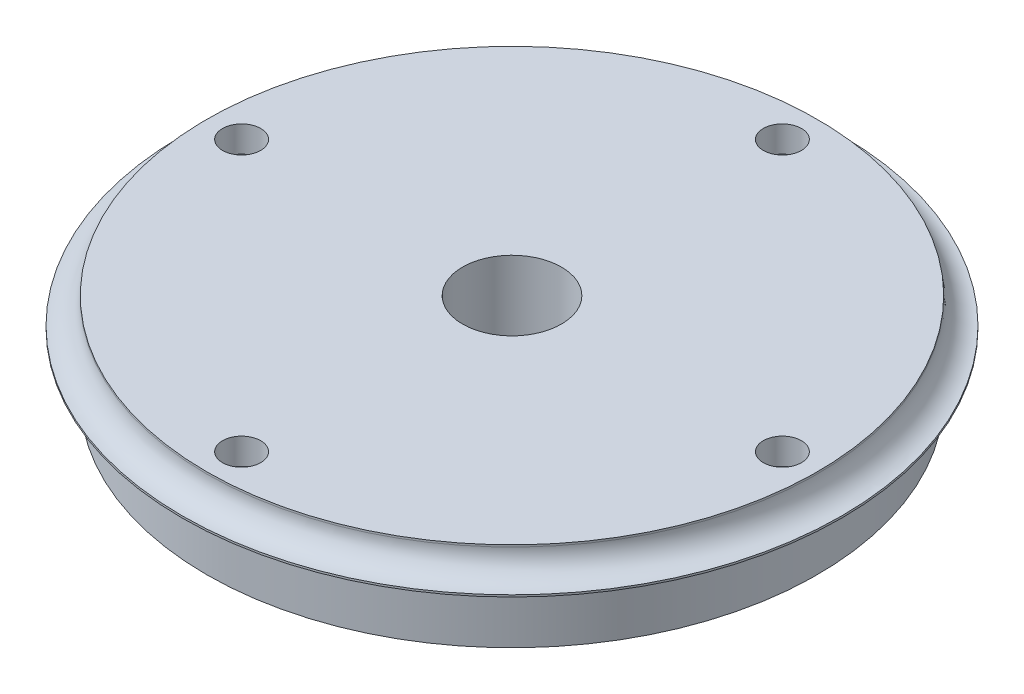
SolidWorks part; units mm, degrees
ref_plane "Front Plane" through (0, 0, 0) normal (0, 0, 1) x (1, 0, 0)
ref_plane "Top Plane" through (0, 0, 0) normal (0, 1, 0) x (1, 0, 0)
ref_plane "Right Plane" through (0, 0, 0) normal (1, 0, 0) x (0, 0, -1)
sketch "Sketch1" plane through (0, 0, 0) normal (0, 1, 0) x (1, 0, 0)
  circle A0 centre (0, 0) radius 40.005
  dimension "D1" = 80.01
extrude "Boss-Extrude1" add sketch "Sketch1" against normal blind 11.684
hole_wizard "M6x1.0 Tapped Hole1" positions "3DSketch1" profile "Sketch3" tap size "M6x1.0" standard "ANSI Metric"
sketch3d "3DSketch1"
  point P0 (0, 0, -35.433)
  dimension "D1" = 35.433
sketch "Sketch3" plane through (0, 0, -35.433) normal (1, 0, 0) x (0, 0, 1)
  line L0 (0, 0) -> (0, 13.1862)
  line L1 (0, 13.1862) -> (2.5, 11.684)
  line L2 (2.5, 11.684) -> (2.5, 0)
  line L5 (2.5, 0) -> (0, 0)
  line L10 (0, 13.1862) -> (-2.5, 11.684) construction
  line L11 (0, -6.35) -> (0, 107.95) construction
  dimension "Tap Drill Dia." = 5
  dimension "Tap Drill Depth" = 11.684
  dimension "Drill Angle" = 118
pattern_circular "CirPattern1" count 4 over 360 about axis through (0, 0, 0) along (0, 1, 0) of "M6x1.0 Tapped Hole1"
sketch "Sketch4" plane through (0, 0, 0) normal (0, 1, 0) x (1, 0, 0)
  circle A0 centre (0, 0) radius 6.477
  dimension "D1" = 12.954
extrude "Cut-Extrude1" cut sketch "Sketch4" against normal through all
ref_plane "Plane1" through (0, -3.429, 0) normal (0, 1, 0) x (1, 0, 0)
sketch "Sketch5" plane through (0, -3.429, 0) normal (0, 1, 0) x (1, 0, 0)
  circle A0 centre (0, 0) radius 43.18
  dimension "D1" = 86.36
extrude "Boss-Extrude2" add sketch "Sketch5" against normal blind 0.254
fillet "Fillet1" radius 3.175 1 edges at (0, -3.429, 40.005)
sketch "Sketch6" plane through (0, -3.429, 0) normal (0, 1, 0) x (1, 0, 0)
  circle A0 centre (0, 0) radius 6.477
extrude "Cut-Extrude2" cut sketch "Sketch6" against normal blind 2.54
